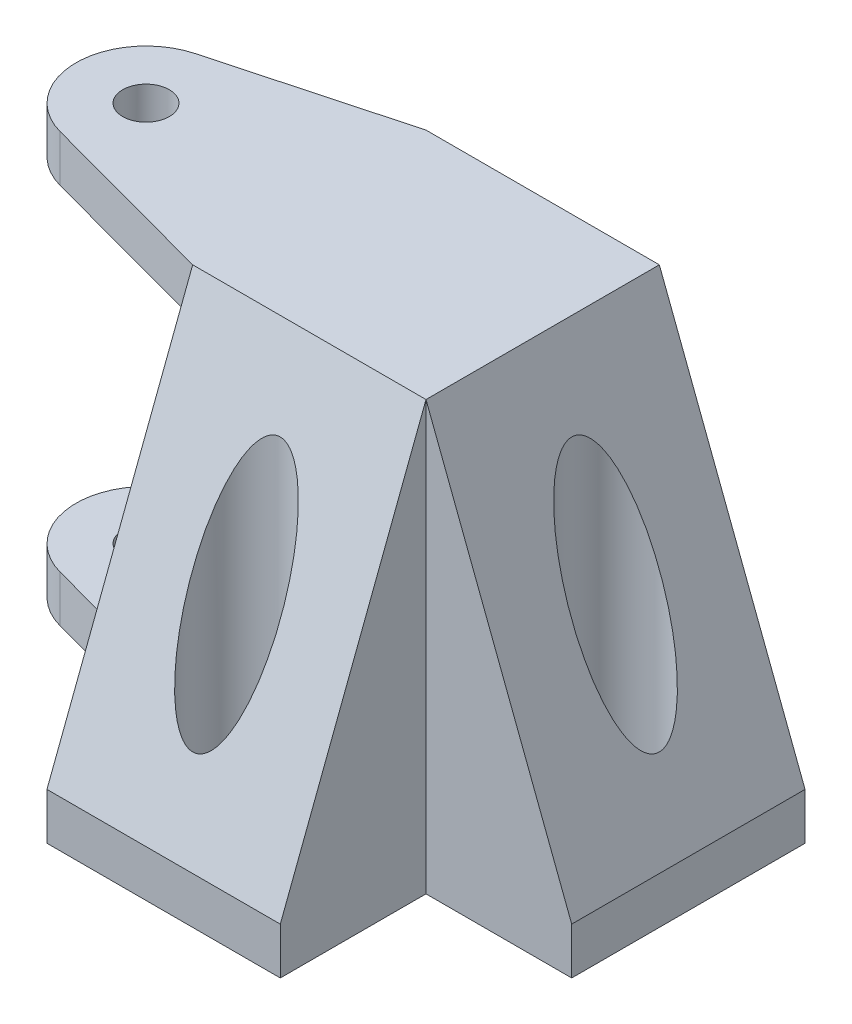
SolidWorks part; units mm, degrees
ref_plane "Front Plane" through (0, 0, 0) normal (0, 0, 1) x (1, 0, 0)
ref_plane "Top Plane" through (0, 0, 0) normal (0, 1, 0) x (1, 0, 0)
ref_plane "Right Plane" through (0, 0, 0) normal (1, 0, 0) x (0, 0, -1)
sketch "Sketch2" plane through (0, 0, 0) normal (0, 0, 1) x (1, 0, 0)
  line L0 (0, 0) -> (-40, 0)
  line L1 (0, 73.3918) -> (24.9782, 8)
  line L2 (24.9782, 8) -> (24.9782, 0)
  line L3 (0, 0) -> (24.9782, 0)
  line L4 (-40, 0) -> (-40, 73.3918)
  line L5 (-40, 73.3918) -> (0, 73.3918)
  dimension "D1" = 40
  dimension "D2" = 8
  dimension "D3" = 70
extrude "Boss-Extrude1" add sketch "Sketch2" along normal blind 40
sketch "Sketch3" plane through (0, 73.3918, 0) normal (0, 1, 0) x (1, 0, 0)
  line L0 (-40, -40) -> (-40, 0) construction
  line L1 (-40, -40) -> (-71.1316, -31.5842)
  line L2 (-40, 0) -> (-71.1316, -8.4158)
  line L3 (-40, 0) -> (-40, -40)
  arc A0 (-71.1316, -31.5842) -> (-71.1316, -8.4158) centre (-68, -20) cw
  point P3 (-80, -20)
  dimension "D2" = 20
  dimension "D1" = 40
extrude "Boss-Extrude2" add sketch "Sketch3" against normal up to vertex (73.3918 mm away) contours L1 A0 L2 L3
sketch "Sketch4" plane through (0, 0, 0) normal (0, 0, 1) x (1, 0, 0)
  line L0 (-40, 73.3918) -> (-40, 65.3918) construction
  line L1 (-40, 73.3918) -> (-40, 0) construction
  line L2 (-40, 73.3918) -> (-71.1316, 73.3918) construction
  line L3 (-40, 0) -> (-40, 8) construction
  line L4 (22, 0) -> (-22, 0) construction
  line L5 (-40, 8) -> (-40, 65.3918)
  line L6 (-40, 65.3918) -> (-80, 65.3918)
  line L7 (-80, 73.3918) -> (-80, 0) construction
  line L8 (-80, 65.3918) -> (-80, 8)
  line L9 (-80, 8) -> (-40, 8)
  dimension "D1" = 8
  dimension "D2" = 8
extrude "Cut-Extrude1" cut sketch "Sketch4" along normal blind 73
sketch "Sketch6" plane through (0, 0, 0) normal (1, 0, 0) x (0, 0, -1)
  line L0 (-40, 73.3918) -> (-64.9782, 8)
  line L1 (-64.9782, 8) -> (-64.9782, 0)
  line L2 (22, 0) -> (-22, 0) construction
  line L3 (-64.9782, 0) -> (-40, 0)
  line L4 (-40, 0) -> (-40, 8) construction
  line L5 (-40, 73.3918) -> (-40, 0)
  dimension "D1" = 8
  dimension "D2" = 70
extrude "Boss-Extrude4" add sketch "Sketch6" against normal blind 40
sketch "Sketch8" plane through (0, 73.3918, 0) normal (0, 1, 0) x (1, 0, 0)
  circle A0 centre (12.4891, -20) radius 4
  circle A1 centre (-20, -52.4891) radius 4
  circle A2 centre (-68, -20) radius 4
  dimension "D1" = 8
  dimension "D2" = 8
  dimension "D3" = 8
extrude "Cut-Extrude2" cut sketch "Sketch8" against normal through all contours A0 | A1 | A2
ref_plane "Plane1" through (0, 5, 0) normal (0, 1, 0) x (1, 0, 0)
sketch "Sketch10" plane through (0, 5, 0) normal (0, 1, 0) x (1, 0, 0)
  circle A0 centre (12.4891, -20) radius 7.5
  circle A1 centre (-20, -52.4891) radius 7.5
  dimension "D1" = 15
  dimension "D2" = 15
extrude "Cut-Extrude3" cut sketch "Sketch10" along normal through all
